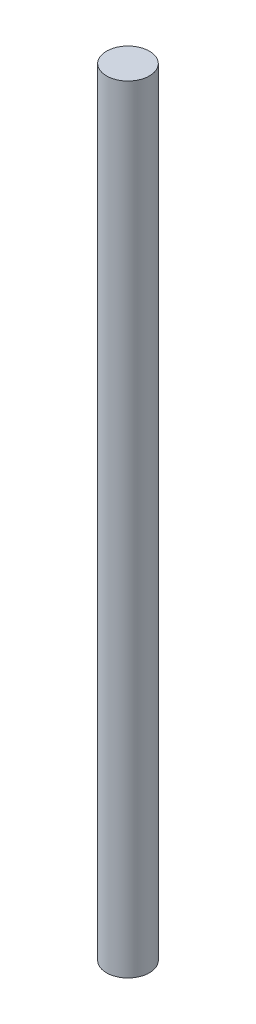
SolidWorks part; units mm, degrees
ref_plane "Front Plane" through (0, 0, 0) normal (0, 0, 1) x (1, 0, 0)
ref_plane "Top Plane" through (0, 0, 0) normal (0, 1, 0) x (1, 0, 0)
ref_plane "Right Plane" through (0, 0, 0) normal (1, 0, 0) x (0, 0, -1)
sketch "Sketch1" plane through (0, 0, 0) normal (0, 1, 0) x (1, 0, 0)
  circle A0 centre (0, 0) radius 4.826
  dimension "D1" = 9.652
extrude "Boss-Extrude1" add sketch "Sketch1" along normal blind 174.752
